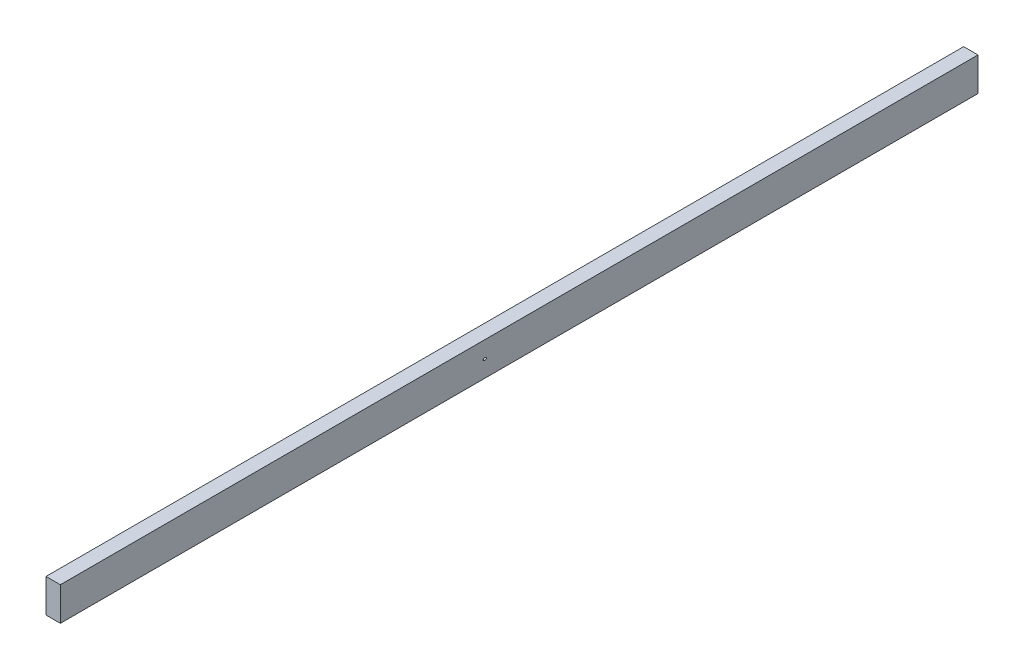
SolidWorks part; units mm, degrees
ref_plane "Front Plane" through (0, 0, 0) normal (0, 0, 1) x (1, 0, 0)
ref_plane "Top Plane" through (0, 0, 0) normal (0, 1, 0) x (1, 0, 0)
ref_plane "Right Plane" through (0, 0, 0) normal (1, 0, 0) x (0, 0, -1)
sketch "Sketch1" plane through (0, 0, 0) normal (0, 0, 1) x (1, 0, 0)
  line L1 (-19.05, -44.45) -> (19.05, -44.45)
  line L2 (-19.05, -44.45) -> (-19.05, 44.45)
  line L3 (-19.05, 44.45) -> (19.05, 44.45)
  line L4 (19.05, -44.45) -> (19.05, 44.45)
  line L5 (-19.05, -44.45) -> (19.05, 44.45) construction
  line L6 (-19.05, 44.45) -> (19.05, -44.45) construction
  point P0 (0, 0)
  dimension "D1" = 38.1
  dimension "D2" = 88.9
extrude "Boss-Extrude1" add sketch "Sketch1" against normal blind 2438.4
sketch "Sketch2" plane through (19.05, 0, 0) normal (1, 0, 0) x (0, 0, -1)
  line L0 (1127.7854, 44.45) -> (1127.7854, -44.45)
  line L1 (2438.4, 44.45) -> (0, 44.45) construction
  line L2 (2438.4, -44.45) -> (0, -44.45) construction
  line L3 (0, -44.45) -> (0, 44.45) construction
  dimension "D1" = 1127.7854
ref_plane "Plane1" through (-554.3677, 0, -554.3677) normal (0.7071, 0, 0.7071) x (0, -1, 0)
sketch "Sketch3" plane through (-554.3677, 0, -554.3677) normal (0.7071, 0, 0.7071) x (0, -1, 0)
  line L0 (-44.45, 810.9351) -> (44.45, 810.9351)
  line L4 (-44.45, 13.4704) -> (44.45, 13.4704)
  line L5 (44.45, 13.4704) -> (44.45, 1737.6796)
  line L6 (44.45, 1737.6796) -> (-44.45, 1737.6796)
  line L7 (-44.45, 1737.6796) -> (-44.45, 13.4704)
  line L8 (-44.45, 13.4704) -> (44.45, 13.4704)
  line L9 (44.45, 13.4704) -> (44.45, 1737.6796)
  line L10 (44.45, 1737.6796) -> (-44.45, 1737.6796)
  line L11 (-44.45, 1737.6796) -> (-44.45, 13.4704)
  circle A0 centre (0, 810.9351) radius 3.175
  dimension "D2" = 6.35
  dimension "D1" = 0
extrude "Cut-Extrude1" cut sketch "Sketch3" against normal blind 28.575 and the other way blind 50.8 contours L0 A0 | L0 A0
sketch "Sketch4" plane through (-574.5733, 0, -574.5733) normal (0.7071, 0, 0.7071) x (0.7071, 0, -0.7071)
  circle A0 centre (810.9351, 0) radius 1.1906
  circle A1 centre (810.9351, 0) radius 3.175
  circle A2 centre (810.9351, 0) radius 3.175
  dimension "D2" = 2.3813
  dimension "D1" = 0
extrude "Cut-Extrude2" cut sketch "Sketch4" against normal through all contours A0
